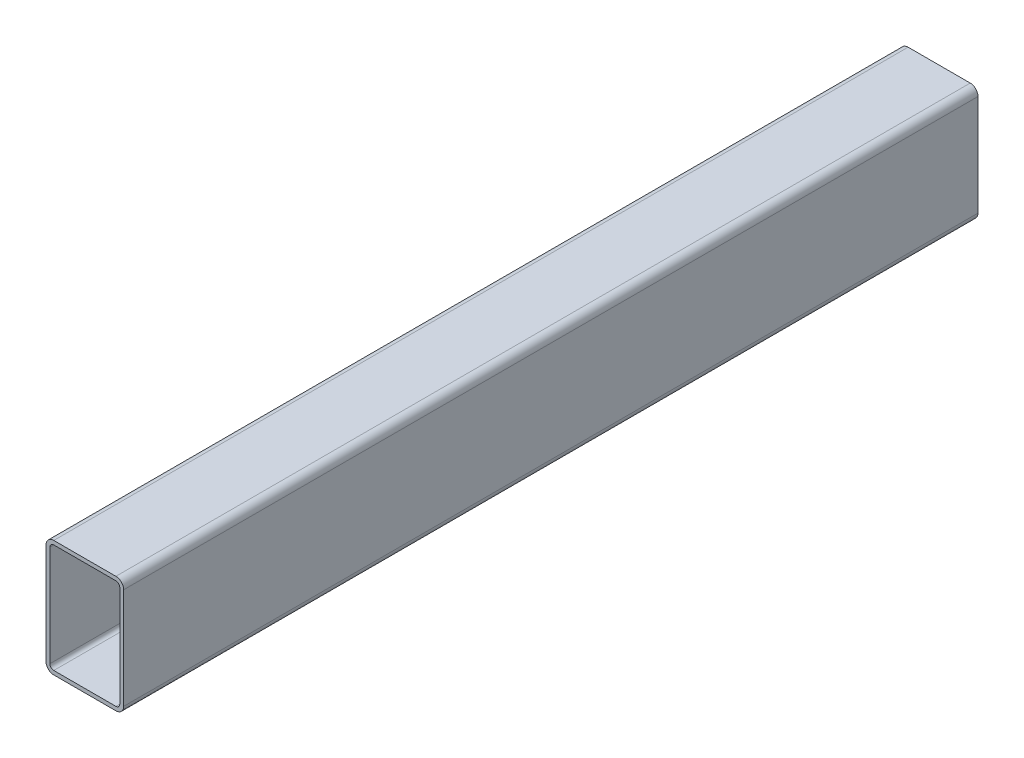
SolidWorks part; units mm, degrees
ref_plane "Plan1" through (0, 0, 0) normal (0, 0, 1) x (1, 0, 0)
ref_plane "Plan2" through (0, 0, 0) normal (0, 1, 0) x (1, 0, 0)
ref_plane "Plan3" through (0, 0, 0) normal (1, 0, 0) x (0, 0, -1)
sketch "Esquisse1" plane through (0, 0, 0) normal (0, 0, 1) x (1, 0, 0)
  line L0 (0, 6.7962) -> (0, -6.7962) construction
  line L1 (16, 30) -> (-16, 30)
  line L2 (20, 26) -> (20, -26)
  line L3 (16, -30) -> (-16, -30)
  line L4 (-20, 26) -> (-20, -26)
  line L5 (-8.1211, 0) -> (8.1211, 0) construction
  arc A0 (-20, 26) -> (-16, 30) centre (-16, 26) cw
  arc A1 (-20, -26) -> (-16, -30) centre (-16, -26) ccw
  arc A2 (20, 26) -> (16, 30) centre (16, 26) ccw
  arc A3 (16, -30) -> (20, -26) centre (16, -26) ccw
  dimension "D1" = 4
  dimension "D2" = 40
  dimension "D3" = 60
extrude "Base-Extru.-Mince" add sketch "Esquisse1" along normal mid plane 440 thin
